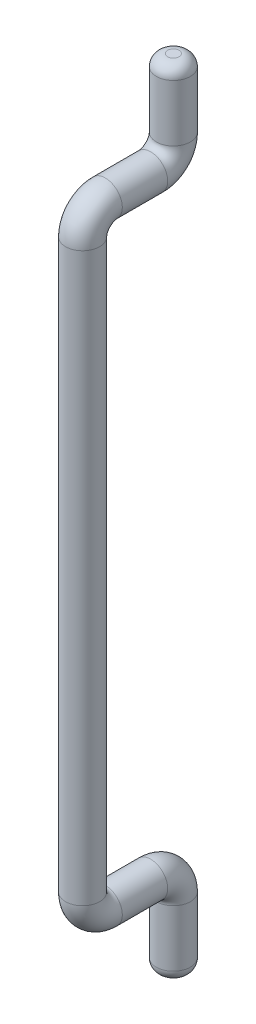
SolidWorks part; units mm, degrees
ref_plane "Front Plane" through (0, 0, 0) normal (0, 0, 1) x (1, 0, 0)
ref_plane "Top Plane" through (0, 0, 0) normal (0, 1, 0) x (1, 0, 0)
ref_plane "Right Plane" through (0, 0, 0) normal (1, 0, 0) x (0, 0, -1)
sketch3d "3DSketch1"
  line L0 (0, 0, 0) -> (0, 3, 0)
  line L1 (0, 4, 1) -> (0, 4, 3)
  line L2 (0, 5, 4) -> (0, 30, 4)
  line L3 (0, 31, 3) -> (0, 31, 1)
  line L4 (0, 32, 0) -> (0, 35, 0)
  arc A1 (0, 31, 1) -> (0, 32, 0) centre (0, 32, 1) ccw
  arc A2 (0, 30, 4) -> (0, 31, 3) centre (0, 30, 3) ccw
  arc A3 (0, 4, 3) -> (0, 5, 4) centre (0, 5, 3) ccw
  arc A4 (0, 3, 0) -> (0, 4, 1) centre (0, 3, 1) ccw
  point P11 (0, 31, 0)
  point P12 (1, 32, 1)
  point P15 (0, 31, 4)
  point P16 (-1, 30, 3)
  point P19 (0, 4, 4)
  point P20 (-1, 5, 3)
  point P23 (0, 4, 0)
  point P24 (1, 3, 1)
  dimension "D7" = 1
  dimension "D1" = 27
  dimension "D2" = 4
  dimension "D3" = 4
  dimension "D4" = 4
  dimension "D5" = 4
sketch "Sketch2" plane through (0, 0, 0) normal (0, 1, 0) x (1, 0, 0)
  circle A0 centre (0, 0) radius 0.75
  dimension "D1" = 1.5
sweep "Sweep1" add profiles "Sketch2" path "3DSketch1"
fillet "Fillet1" radius 0.5 2 edges at (0, 35, 0.75) (0, 0, 0.75)
